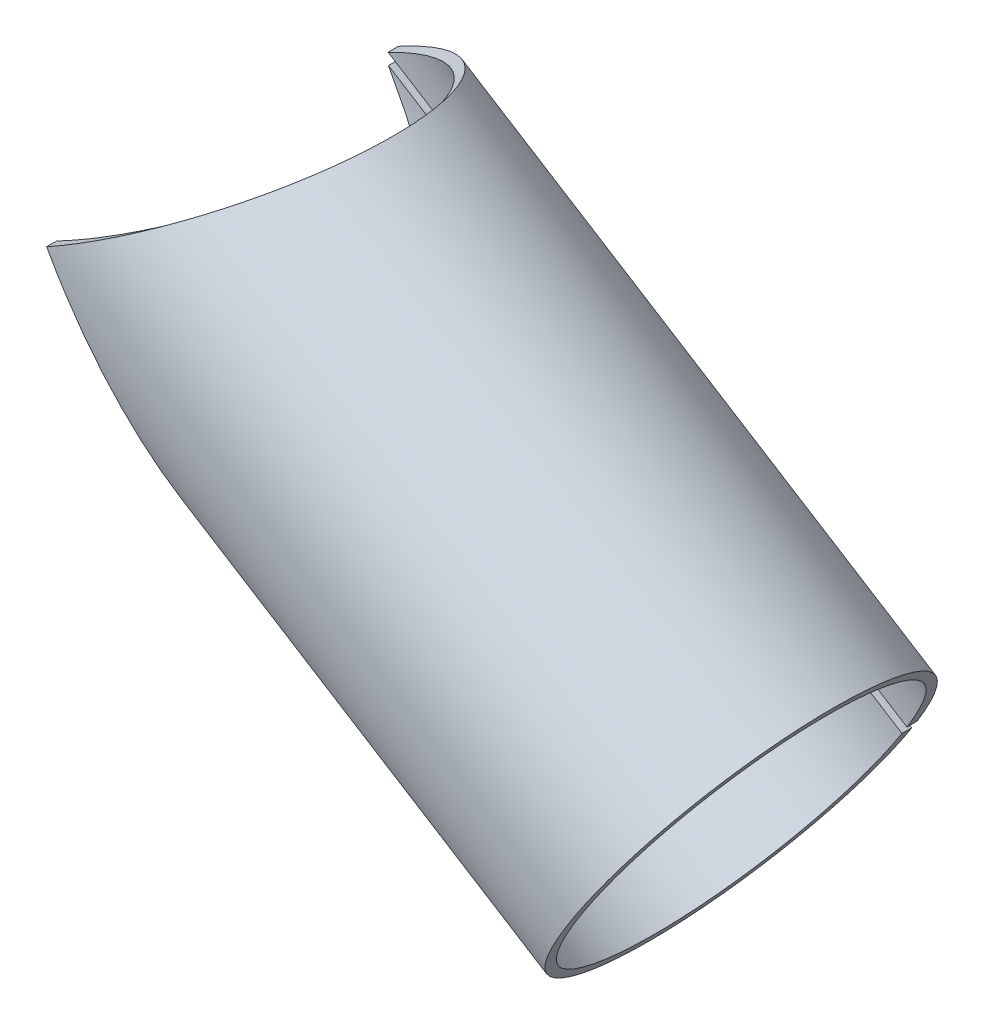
SolidWorks part; units mm, degrees
ref_plane "前视基准面" through (0, 0, 0) normal (0, 0, 1) x (1, 0, 0)
ref_plane "上视基准面" through (0, 0, 0) normal (0, 1, 0) x (1, 0, 0)
ref_plane "右视基准面" through (0, 0, 0) normal (1, 0, 0) x (0, 0, -1)
imported_body "基体零件-任意角度四通管-1"
sheet metal parameters "钣金1" parameters "D1"=0.7366, "厚度"=1
bend "圆角折弯1" bend radius 16.3631 bend angle 356.7 parameters "D5"=1
flatten bends "展开-折弯1" parameters "D1"=0
sketch "尖角-草图1" plane through (26.4808, -15.9983, -17.3559) normal (0.0153, 0.0244, -0.9996) x (-0.9999, 0.0004, -0.0153)
  line L0 (-53.0156, 26.8997) -> (-1.3133, 59.274) construction
process bends "加工-折弯1" parameters "D1"=0
sketch "平面-草图1" plane through (26.4808, -15.9983, -17.3559) normal (0.0153, 0.0244, -0.9996) x (-0.9999, 0.0004, -0.0153)
